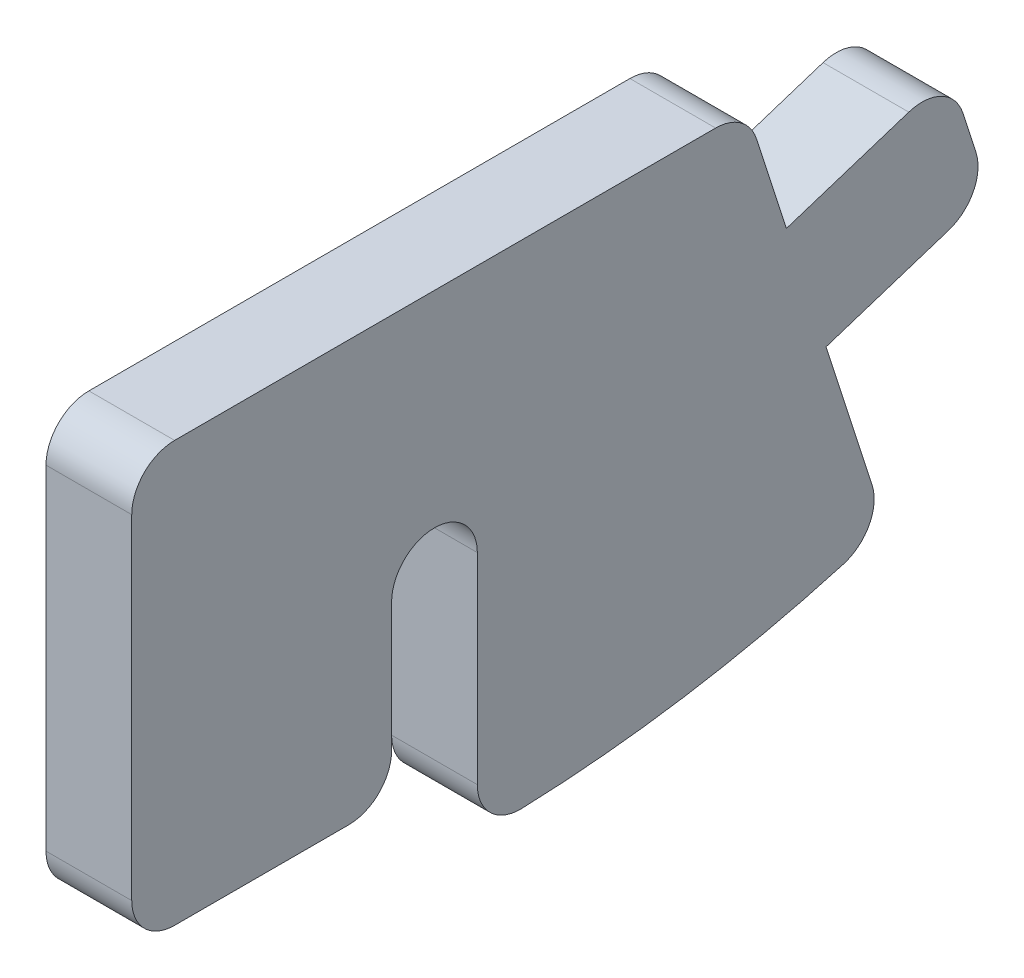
SolidWorks part; units mm, degrees
ref_plane "Plano frontal" through (0, 0, 0) normal (0, 0, 1) x (1, 0, 0)
ref_plane "Plano superior" through (0, 0, 0) normal (0, 1, 0) x (1, 0, 0)
ref_plane "Plano direito" through (0, 0, 0) normal (1, 0, 0) x (0, 0, -1)
sketch "Esboço1" plane through (0, 0, 0) normal (1, 0, 0) x (0, 0, -1)
  line L0 (1, 0) -> (13.62, 0)
  line L1 (14.5714, -0.6922) -> (15.2708, -2.8544)
  line L2 (15.2708, -2.8544) -> (18.1252, -1.931)
  line L3 (19.3844, -2.5747) -> (19.6922, -3.5262)
  line L4 (19.0485, -4.7854) -> (16.1942, -5.7087)
  line L5 (16.1942, -5.7087) -> (17.2694, -9.0326)
  line L6 (8.0613, -10.4849) -> (8.0613, -5.7967)
  line L7 (6.0613, -5.7967) -> (6.0613, -8.7967)
  line L8 (5.0613, -9.7967) -> (1, -9.7967)
  line L9 (0, -8.7967) -> (0, -1)
  arc A0 (16.5938, -10.3016) -> (9.0947, -11.4844) centre (8.0613, 19.4328) cw
  arc A1 (8.0613, -5.7967) -> (6.0613, -5.7967) centre (7.0613, -5.7967) ccw
  arc A2 (13.62, 0) -> (14.5714, -0.6922) centre (13.62, -1) cw
  arc A3 (18.1252, -1.931) -> (19.3844, -2.5747) centre (18.433, -2.8825) cw
  arc A4 (19.6922, -3.5262) -> (19.0485, -4.7854) centre (18.7408, -3.8339) cw
  arc A5 (17.2694, -9.0326) -> (16.5938, -10.3016) centre (16.3179, -9.3404) cw
  arc A6 (9.0947, -11.4844) -> (8.0613, -10.4849) centre (9.0613, -10.4849) cw
  arc A7 (6.0613, -8.7967) -> (5.0613, -9.7967) centre (5.0613, -8.7967) cw
  arc A8 (1, -9.7967) -> (0, -8.7967) centre (1, -8.7967) cw
  arc A9 (1, 0) -> (0, -1) centre (1, -1) ccw
  point P17 (14.3475, 0)
  point P22 (20, -4.4776)
  point P25 (17.5823, -10)
  point P34 (0, 0)
  dimension "D8" = 1
  dimension "D1" = 3
  dimension "D2" = 4
  dimension "D3" = 20
  dimension "D4" = 10
  dimension "D5" = 2
  dimension "D6" = 5
  dimension "D7" = 3
extrude "Ressalto-extrusão1" add sketch "Esboço1" along normal blind 2
